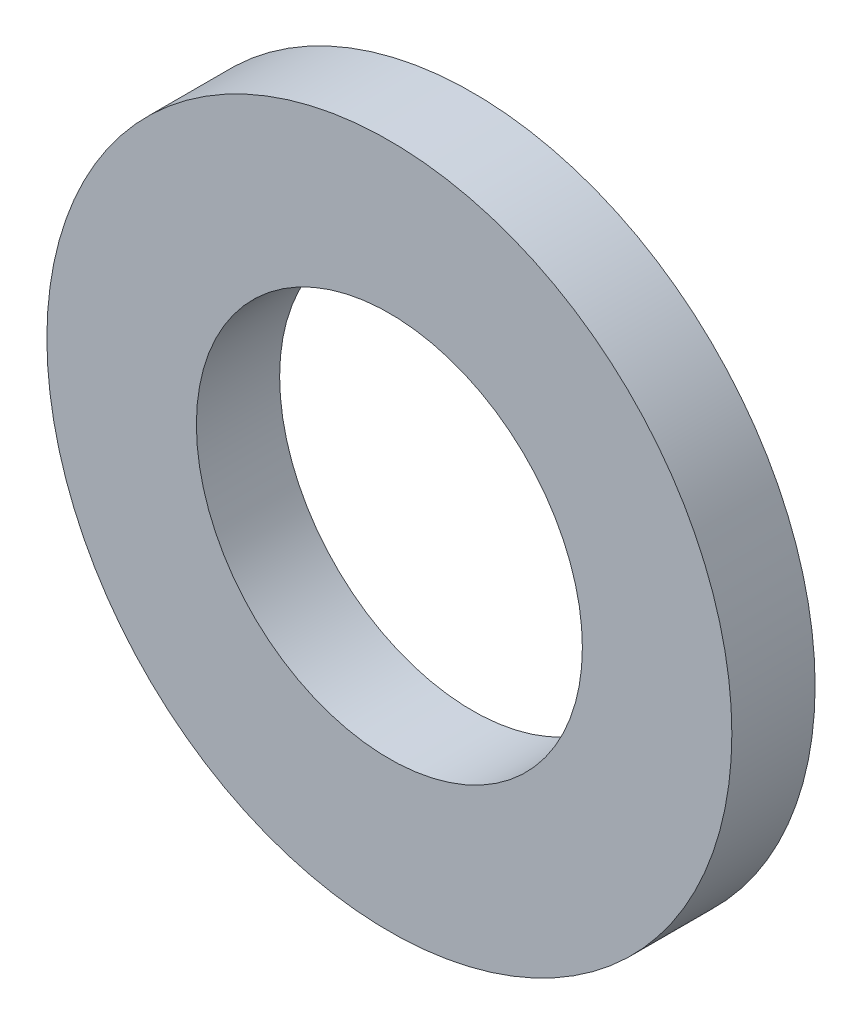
SolidWorks part; units mm, degrees
ref_plane "Front Plane" through (0, 0, 0) normal (0, 0, 1) x (1, 0, 0)
ref_plane "Top Plane" through (0, 0, 0) normal (0, 1, 0) x (1, 0, 0)
ref_plane "Right Plane" through (0, 0, 0) normal (1, 0, 0) x (0, 0, -1)
sketch "Sketch1" plane through (0, 0, 0) normal (0, 0, 1) x (1, 0, 0)
  circle A0 centre (0, 0) radius 9.05
  circle A1 centre (0, 0) radius 5.1
  dimension "D1" = 18.1
  dimension "D2" = 10.2
extrude "Boss-Extrude1" add sketch "Sketch1" along normal blind 2.2
